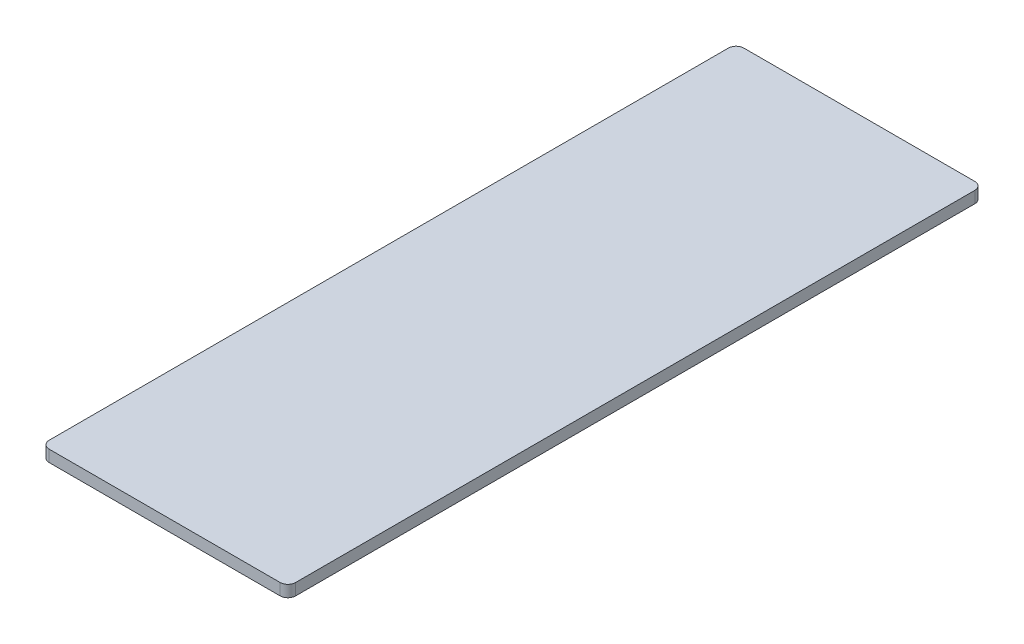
SolidWorks part; units mm, degrees
ref_plane "Plan de face" through (0, 0, 0) normal (0, 0, 1) x (1, 0, 0)
ref_plane "Plan de dessus" through (0, 0, 0) normal (0, 1, 0) x (1, 0, 0)
ref_plane "Plan de droite" through (0, 0, 0) normal (1, 0, 0) x (0, 0, -1)
sketch "Esquisse1" plane through (0, 0, 0) normal (0, 0, 1) x (1, 0, 0)
  line L1 (-66.835, 53.7787) -> (-3.335, 53.7787)
  line L2 (-66.835, 53.7787) -> (-66.835, 50.7787)
  line L3 (-66.835, 50.7787) -> (-3.335, 50.7787)
  line L4 (-3.335, 53.7787) -> (-3.335, 50.7787)
  dimension "D1" = 3
  dimension "D2" = 63.5
extrude "Boss.-Extru.1" add sketch "Esquisse1" along normal blind 179
fillet "Congé1" radius 2 4 edges at (-3.335, 52.2787, 179) (-66.835, 52.2787, 179) (-66.835, 52.2787, 0) (-3.335, 52.2787, 0)
